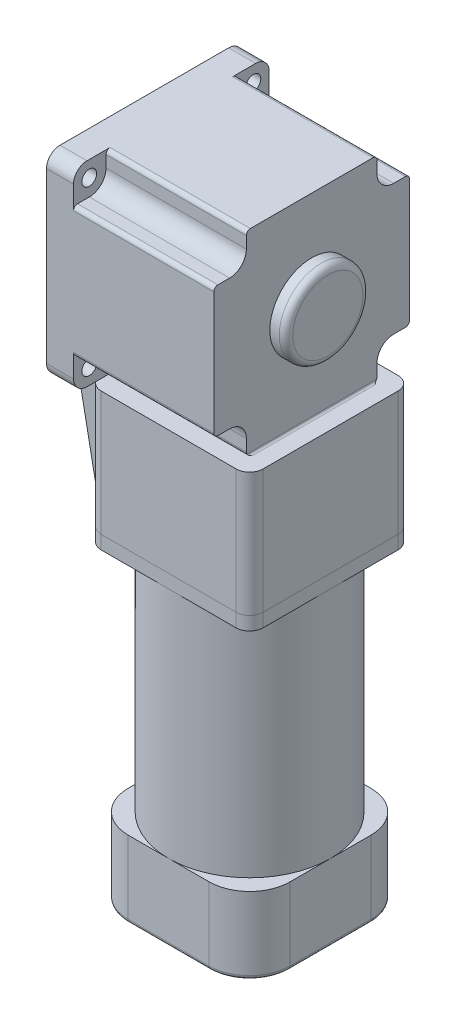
SolidWorks part; units mm, degrees
ref_plane "前视基准面" through (0, 0, 0) normal (0, 0, 1) x (1, 0, 0)
ref_plane "上视基准面" through (0, 0, 0) normal (0, 1, 0) x (1, 0, 0)
ref_plane "右视基准面" through (0, 0, 0) normal (1, 0, 0) x (0, 0, -1)
sketch "草图1" plane through (0, 0, 0) normal (1, 0, 0) x (0, 0, -1)
  line L1 (-62.5, -72.5) -> (62.5, -72.5)
  line L2 (-72.5, -62.5) -> (-72.5, 62.5)
  line L3 (-62.5, 72.5) -> (62.5, 72.5)
  line L4 (72.5, -62.5) -> (72.5, 62.5)
  line L5 (-72.5, -72.5) -> (72.5, 72.5) construction
  line L6 (-72.5, 72.5) -> (72.5, -72.5) construction
  arc A0 (62.5, 72.5) -> (72.5, 62.5) centre (62.5, 62.5) cw
  arc A1 (62.5, -72.5) -> (72.5, -62.5) centre (62.5, -62.5) ccw
  arc A2 (-62.5, -72.5) -> (-72.5, -62.5) centre (-62.5, -62.5) cw
  arc A3 (-72.5, 62.5) -> (-62.5, 72.5) centre (-62.5, 62.5) cw
  point P0 (0, 0)
  dimension "D1" = 10
extrude "凸台-拉伸1" add sketch "草图1" along normal blind 124
sketch "草图2" plane through (124, 0, 0) normal (1, 0, 0) x (0, 0, -1)
  line L0 (-60.8, 48.3958) -> (-69.5, 48.3958)
  line L1 (-72.5, -62.5) -> (-72.5, -45.3958)
  line L3 (-62.5, 72.5) -> (-45.3958, 72.5)
  line L5 (72.5, 62.5) -> (72.5, 45.3958)
  line L6 (-45.3958, -72.5) -> (-62.5, -72.5)
  line L7 (-72.5, 62.5) -> (-72.5, -62.5) construction
  line L8 (45.3958, 72.5) -> (62.5, 72.5)
  line L9 (-69.5, -48.3958) -> (-60.8, -48.3958)
  line L10 (62.5, -72.5) -> (45.3958, -72.5)
  line L11 (-48.3958, -60.8) -> (-48.3958, -69.5)
  line L12 (-62.5, -72.5) -> (62.5, -72.5) construction
  line L13 (72.5, -45.3958) -> (72.5, -62.5)
  line L14 (48.3958, -69.5) -> (48.3958, -60.8)
  line L15 (-72.5, 45.3958) -> (-72.5, 62.5)
  line L16 (60.8, -48.3958) -> (69.5, -48.3958)
  line L17 (72.5, -62.5) -> (72.5, 62.5) construction
  line L19 (69.5, 48.3958) -> (60.8, 48.3958)
  line L21 (48.3958, 60.8) -> (48.3958, 69.5)
  line L22 (62.5, 72.5) -> (-62.5, 72.5) construction
  line L24 (-48.3958, 69.5) -> (-48.3958, 60.8)
  arc A0 (-60.8, 48.3958) -> (-48.3958, 60.8) centre (-60.8, 60.8) ccw
  arc A1 (48.3958, 60.8) -> (60.8, 48.3958) centre (60.8, 60.8) ccw
  arc A2 (60.8, -48.3958) -> (48.3958, -60.8) centre (60.8, -60.8) ccw
  arc A3 (-48.3958, -60.8) -> (-60.8, -48.3958) centre (-60.8, -60.8) ccw
  arc A4 (-45.3958, 72.5) -> (-48.3958, 69.5) centre (-45.3958, 69.5) ccw
  arc A5 (48.3958, 69.5) -> (45.3958, 72.5) centre (45.3958, 69.5) ccw
  arc A6 (72.5, 45.3958) -> (69.5, 48.3958) centre (69.5, 45.3958) ccw
  arc A7 (69.5, -48.3958) -> (72.5, -45.3958) centre (69.5, -45.3958) ccw
  arc A8 (45.3958, -72.5) -> (48.3958, -69.5) centre (45.3958, -69.5) ccw
  arc A9 (-48.3958, -69.5) -> (-45.3958, -72.5) centre (-45.3958, -69.5) ccw
  arc A10 (-72.5, -45.3958) -> (-69.5, -48.3958) centre (-69.5, -45.3958) ccw
  arc A11 (-69.5, 48.3958) -> (-72.5, 45.3958) centre (-69.5, 45.3958) ccw
  arc A12 (-62.5, 72.5) -> (-72.5, 62.5) centre (-62.5, 62.5) ccw
  arc A13 (72.5, 62.5) -> (62.5, 72.5) centre (62.5, 62.5) ccw
  arc A14 (-72.5, -62.5) -> (-62.5, -72.5) centre (-62.5, -62.5) ccw
  arc A15 (62.5, -72.5) -> (72.5, -62.5) centre (62.5, -62.5) ccw
  point P0 (0, 0)
  point P8 (-48.3958, 72.5)
  point P35 (48.3958, 72.5)
  point P38 (72.5, 48.3958)
  point P41 (72.5, -48.3958)
  point P44 (48.3958, -72.5)
  point P47 (-48.3958, -72.5)
  point P50 (-72.5, -48.3958)
  point P53 (-72.5, 48.3958)
  dimension "D1" = 3
extrude "切除-拉伸1" cut sketch "草图2" against normal blind 104
sketch "草图3" plane through (0, 0, 0) normal (-1, 0, 0) x (0, 0, 1)
  circle A0 centre (-60.8, 60.8) radius 5.5
  circle A1 centre (60.8, 60.8) radius 5.5
  circle A2 centre (60.8, -60.8) radius 5.5
  circle A3 centre (-60.8, -60.8) radius 5.5
  point P0 (0, 0)
extrude "切除-拉伸2" cut sketch "草图3" against normal blind 20
sketch "草图4" plane through (0, 0, 0) normal (-1, 0, 0) x (0, 0, 1)
  line L9 (-47.2986, 61.204) -> (-66.9163, 3.204)
  line L10 (-37.8258, 68) -> (37.8258, 68)
  line L11 (47.2986, 61.204) -> (66.9163, 3.204)
  line L13 (-47.2986, -61.204) -> (-66.9163, -3.204)
  line L14 (-37.8258, -68) -> (37.8258, -68)
  line L15 (47.2986, -61.204) -> (66.9163, -3.204)
  arc A0 (37.8258, 68) -> (47.2986, 61.204) centre (37.8258, 58) cw
  arc A1 (66.9163, -3.204) -> (66.9163, 3.204) centre (57.4435, 0) ccw
  arc A2 (37.8258, -68) -> (47.2986, -61.204) centre (37.8258, -58) ccw
  arc A3 (-47.2986, -61.204) -> (-37.8258, -68) centre (-37.8258, -58) ccw
  arc A4 (-66.9163, -3.204) -> (-66.9163, 3.204) centre (-57.4435, 0) cw
  arc A5 (-37.8258, 68) -> (-47.2986, 61.204) centre (-37.8258, 58) ccw
  dimension "D1" = 10
extrude "切除-拉伸3" cut sketch "草图4" against normal blind 1
fillet "圆角2" radius 1 12 edges at (1, 66.1253, -43.655) (1, 68, 0) (1, 66.1253, 43.655) (1, 32.204, 57.1075) (1, 0, 67.4435) (1, -32.204, 57.1075) (1, -66.1253, 43.655) (1, -68, 0) (1, -66.1253, -43.655) (1, -32.204, -57.1075) (1, 0, -67.4435) (1, 32.204, -57.1075)
sketch "草图5" plane through (1, 0, 0) normal (-1, 0, 0) x (0, 0, 1)
  circle A0 centre (0, 0) radius 27.5
extrude "凸台-拉伸2" add sketch "草图5" along normal blind 4
fillet "圆角3" radius 1 1 edges at (-3, 0, 27.5)
ref_plane "基准面1" through (0, 0, 15) normal (0, 0, 1) x (1, 0, 0)
sketch "草图11" plane through (0, -72.5, 0) normal (0, -1, 0) x (1, 0, 0)
  line L3 (28, -60) -> (128, -60)
  line L4 (18, -50) -> (18, 50)
  line L5 (28, 60) -> (128, 60)
  line L6 (138, -50) -> (138, 50)
  line L7 (18, -60) -> (138, 60) construction
  line L8 (18, 60) -> (138, -60) construction
  arc A0 (28, -60) -> (18, -50) centre (28, -50) cw
  arc A1 (128, -60) -> (138, -50) centre (128, -50) ccw
  arc A2 (128, 60) -> (138, 50) centre (128, 50) cw
  arc A3 (18, 50) -> (28, 60) centre (28, 50) cw
  point P3 (78, 0)
  dimension "D1" = 10
extrude "凸台-拉伸7" add sketch "草图11" along normal blind 92
fillet "圆角8" radius 1.5 1 edges at (124, -72.5, 0)
ref_plane "基准面2" through (0, 0, 50) normal (0, 0, 1) x (1, 0, 0)
ref_plane "基准面3" through (0, 0, -50) normal (0, 0, 1) x (1, 0, 0)
sketch "草图12" plane through (0, 0, 50) normal (0, 0, 1) x (1, 0, 0)
  line L0 (18, -72.5) -> (0, -72.5)
  line L1 (0, -72.5) -> (18, -164.5)
  line L2 (18, -164.5) -> (18, -72.5)
extrude "凸台-拉伸8" add sketch "草图12" against normal blind 15
sketch "草图14" plane through (0, 0, -50) normal (0, 0, 1) x (1, 0, 0)
  line L0 (18, -72.5) -> (0, -72.5)
  line L1 (0, -72.5) -> (18, -164.5)
  line L2 (18, -164.5) -> (18, -72.5)
extrude "凸台-拉伸9" add sketch "草图14" along normal blind 15
sketch "草图15" plane through (0, -164.5, 0) normal (0, -1, 0) x (1, 0, 0)
  line L4 (28, -60) -> (128, -60)
  line L5 (18, -50) -> (18, 50)
  line L6 (28, 60) -> (128, 60)
  line L7 (138, -50) -> (138, 50)
  line L8 (18, -60) -> (138, 60) construction
  line L9 (18, 60) -> (138, -60) construction
  arc A0 (128, -60) -> (138, -50) centre (128, -50) ccw
  arc A1 (28, -60) -> (18, -50) centre (28, -50) cw
  arc A2 (18, 50) -> (28, 60) centre (28, 50) cw
  arc A3 (128, 60) -> (138, 50) centre (128, 50) cw
  point P6 (78, 0)
  dimension "D1" = 10
extrude "凸台-拉伸10" add sketch "草图15" along normal blind 10 separate body
sketch "草图16" plane through (0, -174.5, 0) normal (0, -1, 0) x (1, 0, 0)
  circle A0 centre (78, 0) radius 60
extrude "凸台-拉伸11" add sketch "草图16" along normal blind 173 separate body
sketch "草图17" plane through (0, -347.5, 0) normal (0, -1, 0) x (1, 0, 0)
  line L1 (48, -60) -> (108, -60)
  line L2 (18, -30) -> (18, 30)
  line L3 (48, 60) -> (108, 60)
  line L4 (138, -30) -> (138, 30)
  line L5 (18, -60) -> (138, 60) construction
  line L6 (18, 60) -> (138, -60) construction
  arc A0 (108, 60) -> (138, 30) centre (108, 30) cw
  arc A1 (18, 30) -> (48, 60) centre (48, 30) cw
  arc A2 (108, -60) -> (138, -30) centre (108, -30) ccw
  arc A3 (48, -60) -> (18, -30) centre (48, -30) cw
  point P0 (78, 0)
  dimension "D1" = 30
  dimension "D2" = 30
extrude "凸台-拉伸13" add sketch "草图17" along normal blind 57
fillet "圆角9" radius 3 8 edges at (138, -404.5, 0) (129.2132, -404.5, -51.2132) (78, -404.5, -60) (26.7868, -404.5, -51.2132) (18, -404.5, 0) (26.7868, -404.5, 51.2132) (78, -404.5, 60) (129.2132, -404.5, 51.2132)
sketch "草图19" plane through (124, 0, 0) normal (1, 0, 0) x (0, 0, -1)
  circle A0 centre (0, 0) radius 31
extrude "凸台-拉伸14" add sketch "草图19" along normal blind 12
fillet "圆角10" radius 5 1 edges at (136, 0, -31)
sketch "草图22" plane through (-3, 0, 0) normal (-1, 0, 0) x (0, 0, 1)
  line L2 (18.3, -4) -> (14.4568, -4)
  line L4 (14.4568, 4) -> (18.3, 4)
  line L5 (18.3, 4) -> (18.3, -4)
  arc A0 (14.4568, 4) -> (14.4568, -4) centre (0, 0) ccw
extrude "切除-拉伸4" cut sketch "草图22" against normal blind 130
